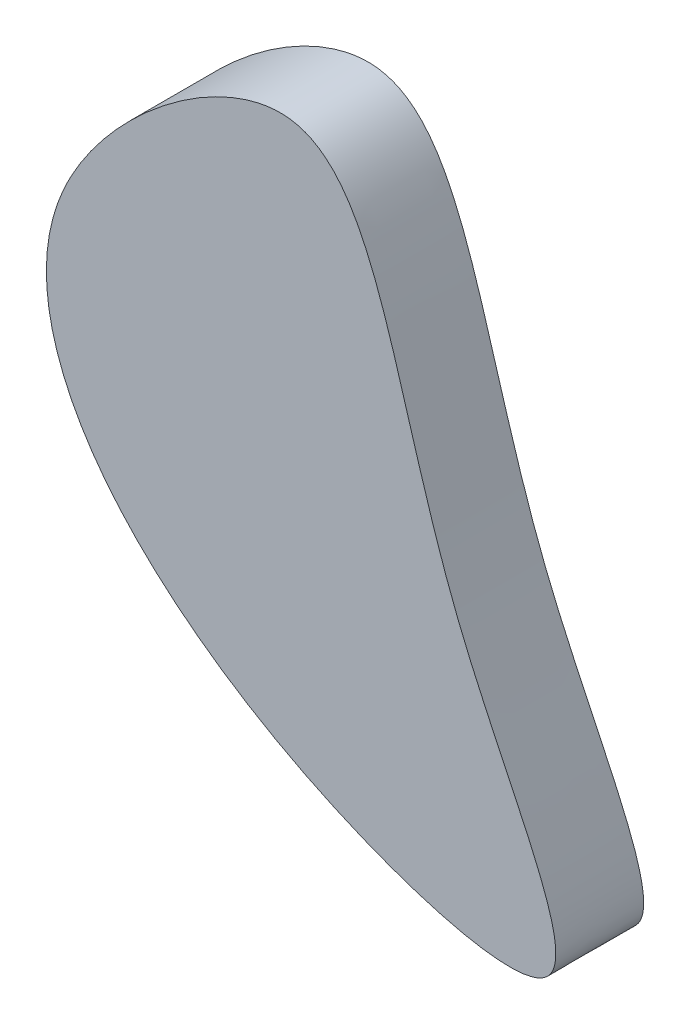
SolidWorks part; units mm, degrees
ref_plane "Front Plane" through (0, 0, 0) normal (0, 0, 1) x (1, 0, 0)
ref_plane "Top Plane" through (0, 0, 0) normal (0, 1, 0) x (1, 0, 0)
ref_plane "Right Plane" through (0, 0, 0) normal (1, 0, 0) x (0, 0, -1)
sketch "Sketch1" plane through (0, 0, 0) normal (0, 0, 1) x (1, 0, 0)
  point P0 (0, 0)
  point P1 (25, 20)
  point P2 (30, -45)
  point P3 (45, -20)
  point P5 (55, -50)
  dimension "D1" = 20
  dimension "D2" = 20
  dimension "D3" = 50
  dimension "D4" = 45
  dimension "D5" = 25
  dimension "D6" = 45
  dimension "D7" = 55
  dimension "D8" = 30
extrude "Extrude1" add sketch "Sketch1" along normal blind 10
